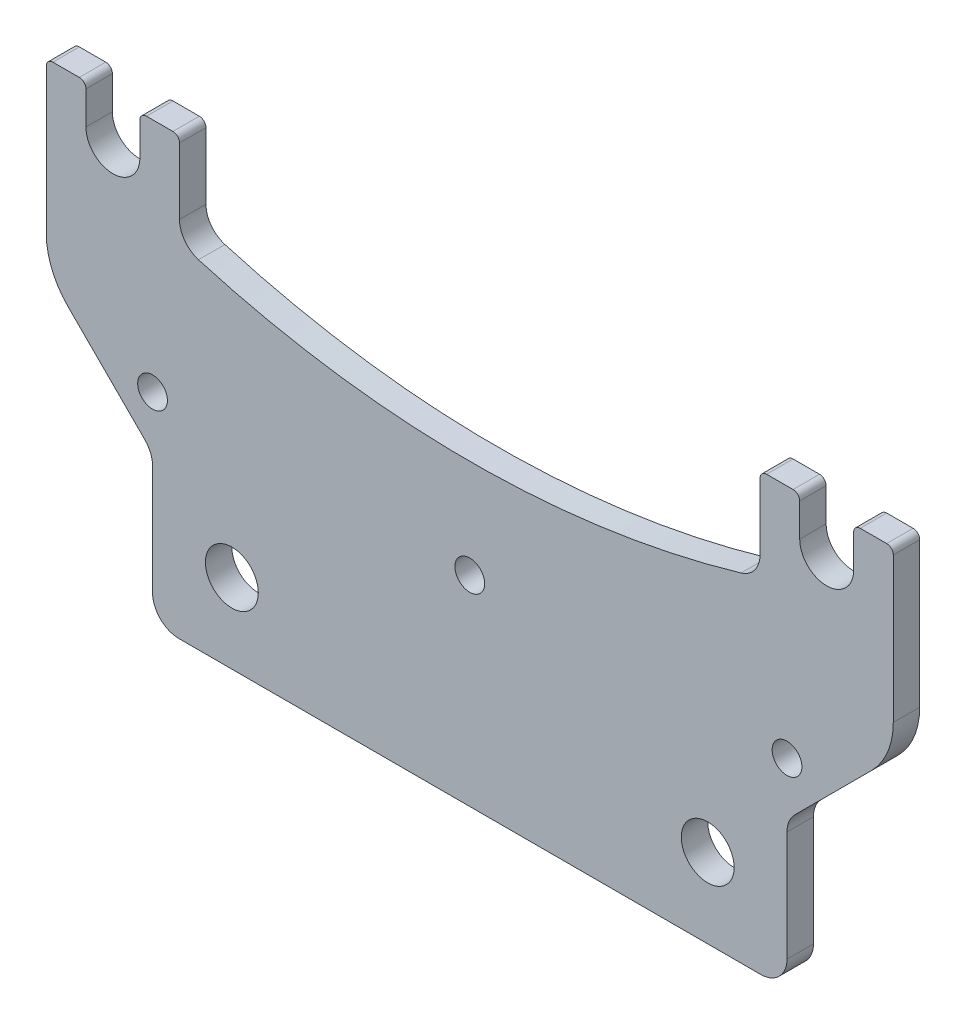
SolidWorks part; units mm, degrees
ref_plane "Front Plane" through (0, 0, 0) normal (0, 0, 1) x (1, 0, 0)
ref_plane "Top Plane" through (0, 0, 0) normal (0, 1, 0) x (1, 0, 0)
ref_plane "Right Plane" through (0, 0, 0) normal (1, 0, 0) x (0, 0, -1)
sketch "Sketch1" plane through (0, 0, 0) normal (0, 0, 1) x (1, 0, 0)
  line L0 (155.448, 0) -> (16.002, 0) construction
  line L1 (85.725, 0) -> (85.725, -76.2) construction
  line L2 (28.575, -76.2) -> (142.875, -76.2) construction
  line L3 (-16.002, 4.7625) -> (-16.002, -69.723)
  line L4 (9.525, -95.25) -> (161.925, -95.25)
  line L5 (9.525, -95.25) -> (-16.002, -69.723)
  line L6 (-6.477, 0) -> (-6.477, 4.7625)
  line L7 (142.875, -76.2) -> (161.925, -95.25) construction
  line L8 (-6.477, 4.7625) -> (-6.477, 9.525)
  line L9 (160.2105, 4.7625) -> (164.973, 4.7625) construction
  line L10 (85.725, -95.25) -> (85.725, -76.2) construction
  line L11 (-16.002, 4.7625) -> (-11.2395, 4.7625) construction
  line L12 (-11.2395, 4.7625) -> (-6.477, 4.7625) construction
  line L13 (0, 0) -> (0, 9.525) construction
  line L14 (16.002, 4.7625) -> (16.002, 0)
  line L15 (16.002, 4.7625) -> (11.2395, 4.7625) construction
  line L16 (11.2395, 4.7625) -> (6.477, 4.7625) construction
  line L17 (6.477, 0) -> (6.477, 4.7625)
  line L18 (6.477, 0) -> (0, 0) construction
  line L19 (28.575, -76.2) -> (9.525, -95.25) construction
  line L20 (155.448, 4.7625) -> (160.2105, 4.7625) construction
  line L21 (171.45, 0) -> (171.45, 9.525) construction
  line L22 (182.6895, 4.7625) -> (177.927, 4.7625) construction
  line L23 (187.452, 4.7625) -> (182.6895, 4.7625) construction
  line L24 (164.973, 0) -> (164.973, 4.7625)
  line L25 (16.002, 0) -> (16.002, -12.7)
  line L26 (177.927, 0) -> (177.927, 4.7625)
  line L27 (161.925, -95.25) -> (187.452, -69.723)
  line L28 (187.452, 4.7625) -> (187.452, -69.723)
  line L29 (0, 9.525) -> (11.2395, 9.525) construction
  line L30 (85.725, 0) -> (85.725, 207.9433) construction
  line L31 (155.448, 0) -> (155.448, -12.7)
  line L32 (-6.477, 9.525) -> (-16.002, 9.525)
  line L33 (-16.002, 9.525) -> (-16.002, 4.7625)
  line L34 (177.927, 4.7625) -> (177.927, 9.525)
  line L35 (177.927, 9.525) -> (187.452, 9.525)
  line L36 (187.452, 9.525) -> (187.452, 4.7625)
  line L37 (155.448, 4.7625) -> (155.448, 0)
  line L38 (6.477, 4.7625) -> (6.477, 9.525)
  line L39 (6.477, 9.525) -> (16.002, 9.525)
  line L40 (16.002, 9.525) -> (16.002, 4.7625)
  line L41 (155.448, 9.525) -> (155.448, 4.7625)
  line L42 (164.973, 9.525) -> (155.448, 9.525)
  line L43 (164.973, 4.7625) -> (164.973, 9.525)
  arc A0 (-6.477, 0) -> (6.477, 0) centre (0, 0) ccw
  arc A1 (164.973, 4.7625) -> (155.448, 4.7625) centre (160.2105, 4.7625) ccw construction
  circle A2 centre (28.575, -76.2) radius 6.35
  circle A3 centre (142.875, -76.2) radius 6.35 construction
  arc A4 (-6.477, 4.7625) -> (-16.002, 4.7625) centre (-11.2395, 4.7625) ccw construction
  arc A5 (6.477, 4.7625) -> (16.002, 4.7625) centre (11.2395, 4.7625) cw construction
  arc A6 (177.927, 4.7625) -> (187.452, 4.7625) centre (182.6895, 4.7625) cw construction
  circle A7 centre (142.875, -76.2) radius 6.35
  arc A8 (177.927, 0) -> (164.973, 0) centre (171.45, 0) cw
  arc A9 (16.002, -12.7) -> (155.448, -12.7) centre (85.725, 207.9433) ccw
  point P11 (85.725, -76.2)
  point P24 (11.2395, 9.525)
  dimension "D2" = 171.45
  dimension "D4" = 12.7
  dimension "D7" = 6.477
  dimension "D12" = 12.7
  dimension "D3" = 76.2
  dimension "D5" = 114.3
  dimension "D6" = 19.05
  dimension "D8" = 9.525
  dimension "D9" = 45
  dimension "D10" = 9.525
  dimension "D11" = 90
extrude "Boss-Extrude1" add sketch "Sketch1" along normal blind 6.35 contours L5 L3 L33 L32 L8 L6 A0 L17 L38 L39 L40 L14 L25 A9 L31 L37 L41 L42 L43 L24 A8 L26 L34 L35 L36 L28 L27 L4
sketch "Sketch4" plane through (0, 0, 6.35) normal (0, 0, 1) x (1, 0, 0)
  line L0 (9.525, -95.25) -> (9.525, -59.817)
  line L2 (9.525, -95.25) -> (161.925, -95.25) construction
  line L3 (9.525, -59.817) -> (-16.002, -34.29)
  line L5 (-16.002, -69.723) -> (9.525, -95.25) construction
  line L6 (-16.002, -34.29) -> (-54.102, -34.29)
  line L7 (-54.102, -34.29) -> (-54.102, -95.25)
  line L8 (-54.102, -95.25) -> (9.525, -95.25)
  line L9 (85.725, -95.25) -> (85.725, -23.4541) construction
  line L10 (225.552, -95.25) -> (161.925, -95.25)
  line L11 (225.552, -34.29) -> (225.552, -95.25)
  line L12 (187.452, -34.29) -> (225.552, -34.29)
  line L13 (161.925, -59.817) -> (187.452, -34.29)
  line L14 (161.925, -95.25) -> (161.925, -59.817)
  line L15 (187.452, -34.29) -> (-16.002, -34.29) construction
  line L16 (-16.002, 9.525) -> (-16.002, -69.723) construction
  arc A0 (16.002, -12.7) -> (155.448, -12.7) centre (85.725, 207.9433) ccw construction
  dimension "D2" = 34.29
  dimension "D3" = 45
  dimension "D4" = 38.1
extrude "Cut-Extrude1" cut sketch "Sketch4" against normal through all contours L7 L8 L0 L3 L6
sketch "Sketch5" plane through (0, 0, 6.35) normal (0, 0, 1) x (1, 0, 0)
  line L0 (9.525, -59.817) -> (9.525, -47.117) construction
  line L1 (9.525, -47.117) -> (-16.002, -47.117) construction
  line L2 (-16.002, -47.117) -> (-16.002, -34.29) construction
  line L3 (161.925, -59.817) -> (161.925, -47.117) construction
  line L4 (161.925, -47.117) -> (187.452, -47.117) construction
  line L5 (187.452, -47.117) -> (187.452, -34.29) construction
  line L6 (9.525, -47.117) -> (161.925, -47.117) construction
  line L7 (85.725, -47.117) -> (85.725, -95.25) construction
  line L8 (9.525, -95.25) -> (161.925, -95.25) construction
  dimension "D1" = 12.7
hole_wizard "1/4 Clearance Hole1" positions "Sketch6" profile "Sketch7" hole size "1/4" standard "ANSI Inch"
sketch "Sketch6" plane through (0, 0, 6.35) normal (0, 0, 1) x (1, 0, 0)
  point P0 (9.525, -47.117)
  point P3 (85.725, -47.117)
  point P6 (161.925, -47.117)
sketch "Sketch7" plane through (9.525, -47.117, 6.35) normal (1, 0, 0) x (0, -1, 0)
  line L0 (0, 0) -> (0, 6.35)
  line L1 (0, 6.35) -> (3.5712, 6.35)
  line L2 (3.5712, 6.35) -> (3.5712, 0)
  line L5 (3.5712, 0) -> (0, 0)
  line L11 (0, -6.35) -> (0, 107.95) construction
  dimension "Thru Hole Dia." = 7.1425
  dimension "Thru Hole Depth" = 6.35
fillet "Fillet1" radius 17.842 2 edges at (187.452, -34.29, 3.175) (-16.002, -34.29, 3.175)
fillet "Fillet2" radius 1.5875 8 edges at (187.452, 9.525, 3.175) (177.927, 9.525, 3.175) (164.973, 9.525, 3.175) (155.448, 9.525, 3.175) (-16.002, 9.525, 3.175) (16.002, 9.525, 3.175) (6.477, 9.525, 3.175) (-6.477, 9.525, 3.175)
fillet "Fillet3" radius 6.35 6 edges at (9.525, -95.25, 3.175) (9.525, -59.817, 3.175) (161.925, -95.25, 3.175) (161.925, -59.817, 3.175) (155.448, -12.7, 3.175) (16.002, -12.7, 3.175)
